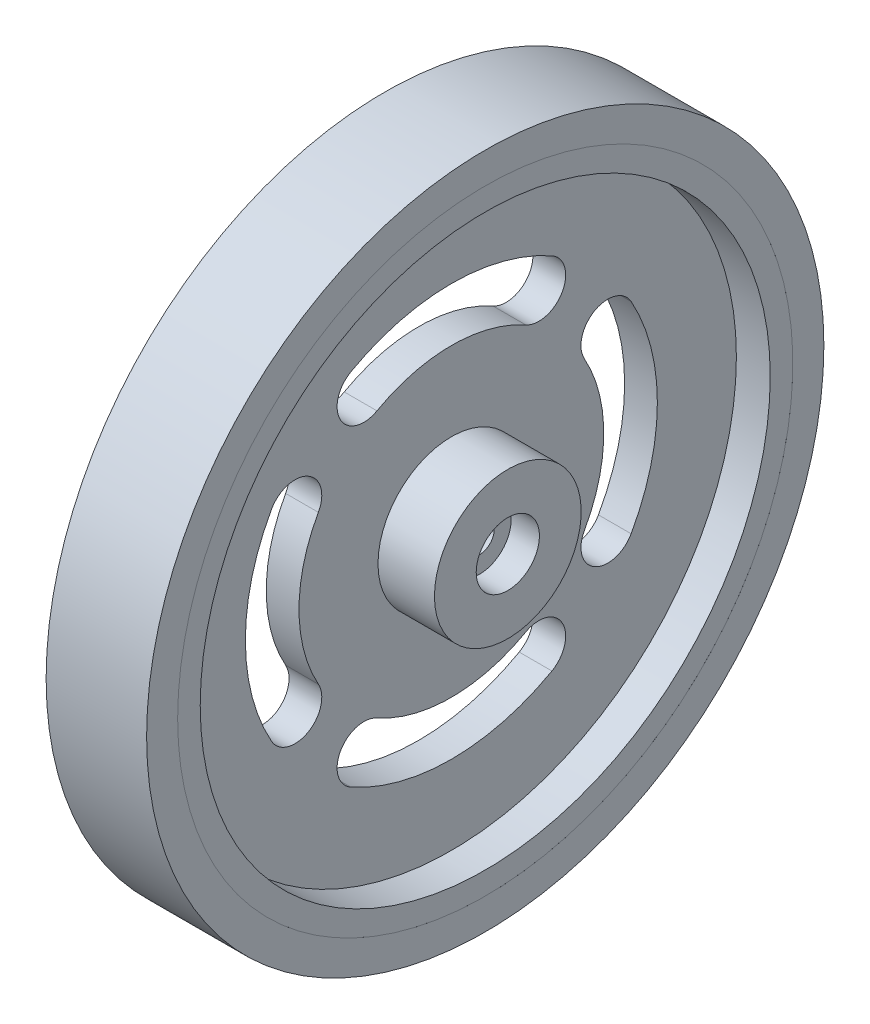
SolidWorks part; units mm, degrees
ref_plane "Alzado" through (0, 0, 0) normal (0, 0, 1) x (1, 0, 0)
ref_plane "Planta" through (0, 0, 0) normal (0, 1, 0) x (1, 0, 0)
ref_plane "Vista lateral" through (0, 0, 0) normal (1, 0, 0) x (0, 0, -1)
sketch "Croquis1" plane through (0, 0, 0) normal (0, 0, 1) x (1, 0, 0)
  line L0 (-3, 0) -> (5.4, 0) construction
  line L3 (0, 1.3) -> (0, 25.25)
  line L4 (0, 25.25) -> (-3, 25.25)
  line L5 (-3, 25.25) -> (-3, 27.25)
  line L6 (-3, 27.25) -> (5.9, 27.25)
  line L7 (5.9, 27.25) -> (5.9, 25.25)
  line L8 (5.9, 25.25) -> (2.9, 25.25)
  line L9 (2.9, 25.25) -> (2.9, 6.5)
  line L10 (2.9, 6.5) -> (7.9, 6.5)
  line L11 (7.9, 6.5) -> (7.9, 2.8)
  line L12 (-3, 27.25) -> (-3.001, 27.25)
  line L13 (5.4, 2.8) -> (7.9, 2.8)
  line L14 (5.4, 2.8) -> (5.4, 1.3)
  line L15 (5.4, 1.3) -> (0, 1.3)
  line L16 (-3.001, 27.25) -> (-3.001, 30)
  line L17 (-3.001, 30) -> (5.901, 30)
  line L18 (5.901, 30) -> (5.901, 27.25)
  line L19 (5.901, 27.25) -> (5.9, 27.25)
  dimension "D2" = 8.4
  dimension "D3" = 3
  dimension "D4" = 2.6
  dimension "D5" = 8.9
  dimension "D6" = 2.9
  dimension "D8" = 5
  dimension "D9" = 3.7
  dimension "D11" = 2.5
  dimension "D12" = 1.5
  dimension "D13" = 27.25
  dimension "D14" = 25.25
  dimension "D15" = 0.001
  dimension "D16" = 0.001
  dimension "D17" = 30
revolve "Revolución1" add sketch "Croquis1" angle 360 about L0
sketch "Croquis2" plane through (0, 0, 0) normal (-1, 0, 0) x (0, 0, 1)
  line L0 (0, 0) -> (0, 40.9523) construction
  arc A0 (6.5906, 11.782) -> (-6.5906, 11.782) centre (0, 0) ccw
  arc A1 (8.9094, 15.9275) -> (-8.9094, 15.9275) centre (0, 0) ccw
  circle A2 centre (0, 0) radius 15.875 construction
  arc A3 (-8.9094, 15.9275) -> (-6.5906, 11.782) centre (-7.75, 13.8547) ccw
  arc A4 (6.5906, 11.782) -> (8.9094, 15.9275) centre (7.75, 13.8547) ccw
  arc A5 (15.9275, -8.9094) -> (15.9275, 8.9094) centre (0, 0) ccw
  arc A6 (15.9275, 8.9094) -> (11.782, 6.5906) centre (13.8547, 7.75) ccw
  arc A7 (11.782, -6.5906) -> (11.782, 6.5906) centre (0, 0) ccw
  arc A8 (11.782, -6.5906) -> (15.9275, -8.9094) centre (13.8547, -7.75) ccw
  arc A9 (-8.9094, -15.9275) -> (8.9094, -15.9275) centre (0, 0) ccw
  arc A10 (8.9094, -15.9275) -> (6.5906, -11.782) centre (7.75, -13.8547) ccw
  arc A11 (-6.5906, -11.782) -> (6.5906, -11.782) centre (0, 0) ccw
  arc A12 (-6.5906, -11.782) -> (-8.9094, -15.9275) centre (-7.75, -13.8547) ccw
  arc A13 (-15.9275, 8.9094) -> (-15.9275, -8.9094) centre (0, 0) ccw
  arc A14 (-15.9275, -8.9094) -> (-11.782, -6.5906) centre (-13.8547, -7.75) ccw
  arc A15 (-11.782, 6.5906) -> (-11.782, -6.5906) centre (0, 0) ccw
  arc A16 (-11.782, 6.5906) -> (-15.9275, 8.9094) centre (-13.8547, 7.75) ccw
  circle A17 centre (0, 0) radius 13.5 construction
  circle A18 centre (0, 0) radius 18.25 construction
  dimension "D1" = 27
  dimension "D2" = 36.5
  dimension "D3" = 31.75
  dimension "D6" = 36.5
  dimension "D4" = 15.5
  dimension "D5" = 4
extrude "Cortar-Extruir1" cut sketch "Croquis2" against normal blind 10
sketch "Croquis3" plane through (0, 0, 0) normal (-1, 0, 0) x (0, 0, 1)
  line L0 (-2.0791, 1.8) -> (2.0791, 1.8)
  line L1 (0, 0) -> (2.75, 0) construction
  line L2 (-2.0791, -1.8) -> (2.0791, -1.8)
  circle A0 centre (0, 0) radius 4.5
  arc A1 (-2.0791, 1.8) -> (-2.0791, -1.8) centre (0, 0) ccw
  arc A2 (2.0791, -1.8) -> (2.0791, 1.8) centre (0, 0) ccw
  dimension "D1" = 3.6
  dimension "D2" = 2.75
  dimension "D3" = 9
extrude "Saliente-Extruir1" add sketch "Croquis3" along normal blind 3
sketch "Croquis4" plane through (0, 0, 0) normal (-1, 0, 0) x (0, 0, 1)
  line L0 (-2.0791, 1.8) -> (2.0791, 1.8)
  line L1 (2.0791, 1.8) -> (-2.0791, 1.8) construction
  line L2 (-2.0791, -1.8) -> (2.0791, -1.8)
  arc A0 (-2.0791, 1.8) -> (-2.0791, -1.8) centre (0, 0) ccw
  arc A1 (2.0791, -1.8) -> (2.0791, 1.8) centre (0, 0) ccw
extrude "Cortar-Extruir2" cut sketch "Croquis4" against normal blind 1.2
